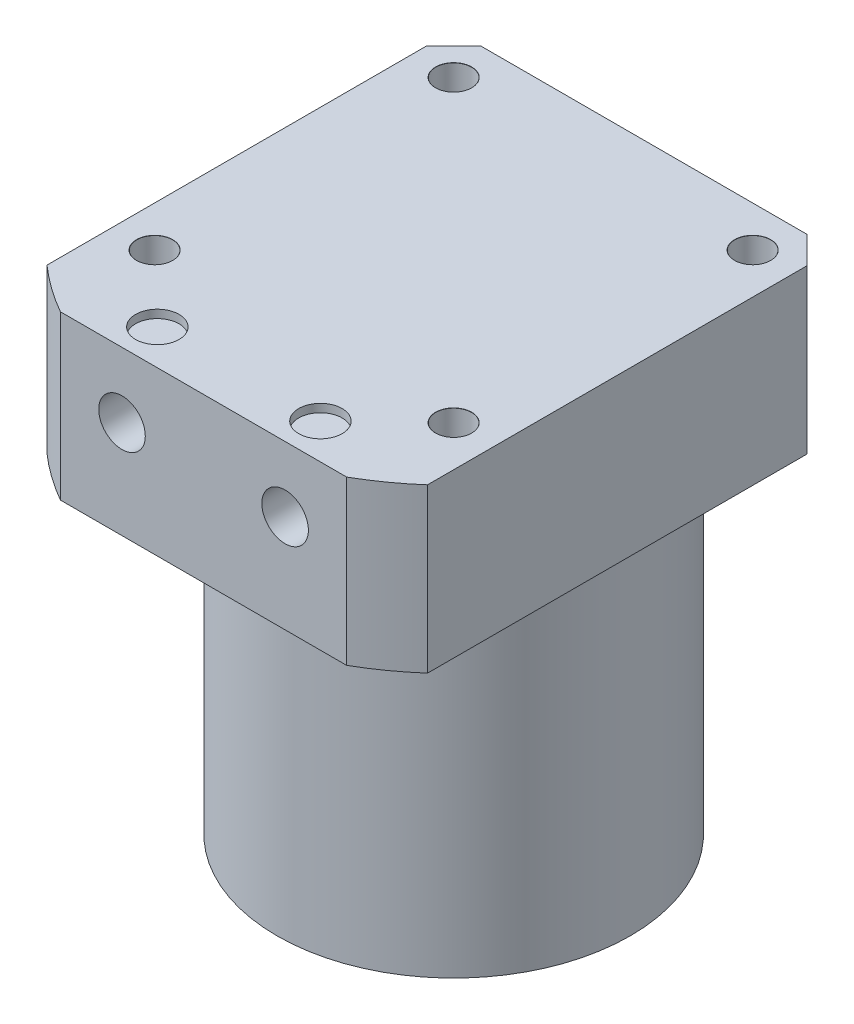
SolidWorks part; units mm, degrees
ref_plane "Front Plane" through (0, 0, 0) normal (0, 0, 1) x (1, 0, 0)
ref_plane "Top Plane" through (0, 0, 0) normal (0, 1, 0) x (1, 0, 0)
ref_plane "Right Plane" through (0, 0, 0) normal (1, 0, 0) x (0, 0, -1)
sketch "Sketch1" plane through (0, 0, 0) normal (0, 0, 1) x (1, 0, 0)
  line L0 (0, 87.0508) -> (0, 0) construction
  line L1 (0, 0) -> (-32.5, 0)
  line L2 (-32.5, 0) -> (-32.5, 63)
  line L3 (-32.5, 63) -> (-53, 63)
  line L4 (-53, 63) -> (-53, 93)
  line L6 (-53, 93) -> (0, 93)
  line L7 (0, 0) -> (0, 93)
  dimension "D1" = 32.5
  dimension "D2" = 63
  dimension "D3" = 53
  dimension "D5" = 30
revolve "Revolve1" add sketch "Sketch1" angle 360 about L0
sketch "Sketch2" plane through (0, 93, 0) normal (0, 1, 0) x (1, 0, 0)
  line L0 (0, 0) -> (0, 35) construction
  line L1 (-35, 35) -> (35, 35)
  line L2 (-35, 35) -> (-35, -46)
  line L3 (-35, -46) -> (35, -46)
  line L4 (35, 35) -> (35, -46)
  dimension "D1" = 81
  dimension "D2" = 70
  dimension "D3" = 35
extrude "Cut-Extrude2" cut sketch "Sketch2" against normal through all flip side to cut
chamfer "Chamfer1" distance 5 angle 45 2 edges at (35, 78, -35) (-35, 78, -35)
hole_wizard "Ø8.0 (8) Diameter Hole1" positions "Sketch4" profile "Sketch3" hole size "Ø8.0" standard "ISO"
sketch "Sketch4" plane through (-22.9405, 93, 22.7051) normal (0, -1, 0) x (1, 0, 0)
  line L0 (7.9405, 16.7949) -> (37.9405, 16.7949) construction
  line L2 (22.9405, 16.7949) -> (22.9405, -22.7051) construction
  point P0 (7.9405, 16.7949)
  point P1 (37.9405, 16.7949)
  dimension "D1" = 30
  dimension "D2" = 39.5
sketch "Sketch3" plane through (-15, 93, 39.5) normal (1, 0, 0) x (0, 0, 1)
  line L0 (0, 0) -> (0, 1.5)
  line L1 (0, 1.5) -> (4, 1.5)
  line L2 (4, 1.5) -> (4, 0)
  line L5 (4, 0) -> (0, 0)
  line L10 (0, 1.5) -> (-4, 1.5) construction
  line L11 (0, -6.35) -> (0, 107.95) construction
  dimension "Hole Dia." = 8
  dimension "Hole Depth" = 1.5
  dimension "Drill Angle" = 180
hole_wizard "G1/8 Tapped Hole1" positions "Sketch6" profile "Sketch5" tap size "G1/8" standard "ISO"
sketch "Sketch6" plane through (0, 0, 46) normal (0, 0, 1) x (1, 0, 0)
  line L0 (-15, 81) -> (15, 81) construction
  line L4 (0, 81) -> (0, 93) construction
  line L5 (-26.3249, 93) -> (26.3249, 93) construction
  point P0 (-15, 81)
  point P1 (15, 81)
  dimension "D1" = 12
  dimension "D2" = 30
sketch "Sketch5" plane through (-15, 81, 46) normal (1, 0, 0) x (0, -1, 0)
  line L0 (0, 0) -> (0, 22.18)
  line L1 (0, 22.18) -> (4.283, 22.18)
  line L2 (4.283, 22.18) -> (4.283, 0)
  line L5 (4.283, 0) -> (0, 0)
  line L10 (0, 22.18) -> (-4.283, 22.18) construction
  line L11 (0, -6.35) -> (0, 107.95) construction
  dimension "Tap Drill Dia." = 8.566
  dimension "Tap Drill Depth" = 22.18
  dimension "Drill Angle" = 180
hole_wizard "CBORE for M6 Hex Socket Head Cap Screw1" positions "Sketch8" profile "Sketch7" counterbore size "M6" standard "ISO"
sketch "Sketch8" plane through (-33.2535, 63, 49.2524) normal (0, 1, 0) x (-1, 0, 0)
  line L1 (-5.7535, -21.7524) -> (-60.7535, -21.7524)
  line L2 (-5.7535, -21.7524) -> (-5.7535, -76.7524)
  line L3 (-5.7535, -76.7524) -> (-60.7535, -76.7524)
  line L4 (-60.7535, -21.7524) -> (-60.7535, -76.7524)
  line L7 (-33.2535, -49.2524) -> (-33.2535, -21.7524) construction
  line L9 (-33.2535, -49.2524) -> (-5.7535, -49.2524) construction
  point P0 (-5.7535, -76.7524)
  point P1 (-60.7535, -76.7524)
  point P3 (-60.7535, -21.7524)
  point P5 (-5.7535, -21.7524)
  dimension "D1" = 55
  dimension "D2" = 55
sketch "Sketch7" plane through (-27.5, 63, -27.5) normal (1, 0, 0) x (0, 0, -1)
  line L0 (0, 0) -> (0, 30)
  line L1 (3.3, 29.975) -> (3.325, 30)
  line L2 (3.3, 29.975) -> (3.3, 6)
  line L3 (3.3, 6) -> (5.5, 6)
  line L4 (5.5, 6) -> (5.5, 0)
  line L5 (5.5, 0) -> (0, 0)
  line L11 (0, -6.35) -> (0, 107.95) construction
  line L12 (3.325, 30) -> (0, 30)
  line L13 (-3.3, 29.975) -> (-3.325, 30) construction
  dimension "Thru Hole Dia." = 6.6
  dimension "Thru Hole Depth" = 30
  dimension "C'Bore Dia." = 11
  dimension "C'Bore Depth" = 6
  dimension "Far C'Sink Dia." = 6.65
  dimension "Far C'Sink Angle" = 90
